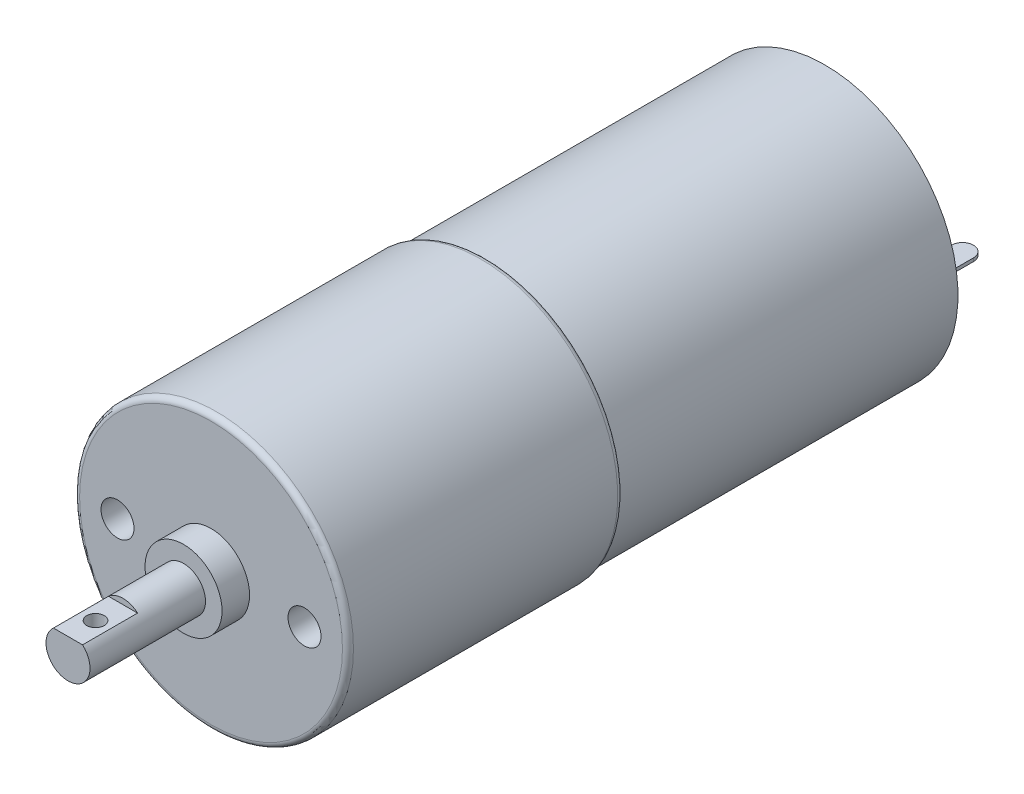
SolidWorks part; units mm, degrees
ref_plane "Front Plane" through (0, 0, 0) normal (0, 0, 1) x (1, 0, 0)
ref_plane "Top Plane" through (0, 0, 0) normal (0, 1, 0) x (1, 0, 0)
ref_plane "Right Plane" through (0, 0, 0) normal (1, 0, 0) x (0, 0, -1)
sketch "Sketch2" plane through (0, 0, 0) normal (0, 0, 1) x (1, 0, 0)
  circle A0 centre (0, 0) radius 12.0904
  dimension "D1" = 24.1808
extrude "Boss-Extrude1" add sketch "Sketch2" along normal blind 30.8
sketch "Sketch4" plane through (0, 0, 30.8) normal (0, 0, 1) x (1, 0, 0)
  circle A0 centre (0, 0) radius 12.446
  dimension "D1" = 24.892
extrude "Boss-Extrude2" add sketch "Sketch4" along normal blind 25
sketch "Sketch5" plane through (0, 0, 55.8) normal (0, 0, 1) x (1, 0, 0)
  circle A0 centre (0, 0) radius 3.5
  dimension "D1" = 7
extrude "Boss-Extrude3" add sketch "Sketch5" along normal blind 2.5
sketch "Sketch6" plane through (0, 0, 58.3) normal (0, 0, 1) x (1, 0, 0)
  circle A0 centre (0, 0) radius 2
  dimension "D1" = 4
extrude "Boss-Extrude4" add sketch "Sketch6" along normal blind 10.5 separate body
sketch "Sketch7" plane through (0, 0, 68.8) normal (0, 0, 1) x (1, 0, 0)
  line L0 (-1.3229, 1.5) -> (1.3229, 1.5)
  circle A0 centre (0, 0) radius 2 construction
  arc A1 (1.3229, 1.5) -> (-1.3229, 1.5) centre (0, 0) ccw
  point P5 (0, -2)
  dimension "D1" = 3.5
extrude "Cut-Extrude1" cut sketch "Sketch7" against normal blind 5
fillet "Fillet1" radius 0.5 2 edges at (12.446, 0, 30.8) (12.446, 0, 55.8)
sketch "Sketch8" plane through (0, 0, 55.8) normal (0, 0, 1) x (1, 0, 0)
  line L0 (-8.5, 0) -> (8.5, 0) construction
  circle A0 centre (8.5, 0) radius 1.5
  circle A1 centre (-8.5, 0) radius 1.5
  dimension "D1" = 3
  dimension "D2" = 17
extrude "Cut-Extrude2" cut sketch "Sketch8" against normal blind 3.5
sketch "Sketch9" plane through (0, 0, 0) normal (0, 0, -1) x (-1, 0, 0)
  circle A0 centre (0, 0) radius 2.5376
extrude "Boss-Extrude5" add sketch "Sketch9" along normal blind 2
sketch "Sketch10" plane through (0, 0, 0) normal (0, 0, -1) x (-1, 0, 0)
  line L0 (0, 0) -> (0, 6.5277) construction
  line L1 (-10, 0.15) -> (-8, 0.15)
  line L2 (-10, 0.15) -> (-10, -0.15)
  line L3 (-10, -0.15) -> (-8, -0.15)
  line L4 (-8, 0.15) -> (-8, -0.15)
  line L5 (-10, 0.15) -> (-8, -0.15) construction
  line L6 (-10, -0.15) -> (-8, 0.15) construction
  line L11 (10, -0.15) -> (8, 0.15) construction
  line L12 (10, 0.15) -> (8, -0.15) construction
  line L13 (8, 0.15) -> (8, -0.15)
  line L14 (10, -0.15) -> (8, -0.15)
  line L15 (10, 0.15) -> (10, -0.15)
  line L16 (10, 0.15) -> (8, 0.15)
  point P0 (-9, 0)
  point P6 (-8, 0)
  point P13 (8, 0)
  point P14 (9, 0)
  dimension "D1" = 2
  dimension "D2" = 0.3
  dimension "D3" = 9
extrude "Boss-Extrude6" add sketch "Sketch10" along normal blind 4.5
fillet "Fillet2" radius 1 4 edges at (-10, 0, -4.5) (-8, 0, -4.5) (10, 0, -4.5) (8, 0, -4.5)
fillet "Fillet11" radius 0.5 1 edges at (-2.5376, 0, -2)
sketch "Sketch11" plane through (0, 1.5, 0) normal (0, 1, 0) x (1, 0, 0)
  line L0 (0, -68.8) -> (0, -63.8) construction
  line L1 (-1.3229, -68.8) -> (1.3229, -68.8) construction
  line L2 (-1.3229, -63.8) -> (1.3229, -63.8) construction
  circle A0 centre (0, -66.3) radius 0.7937
  dimension "D1" = 1.5875
extrude "Cut-Extrude3" cut sketch "Sketch11" against normal through all
equation "\"L\"= 25mm"
equation "\"D1@Boss-Extrude2\"=\"L\""
equation "\"D1@Boss-Extrude4\"=13mm-2.5mm"
